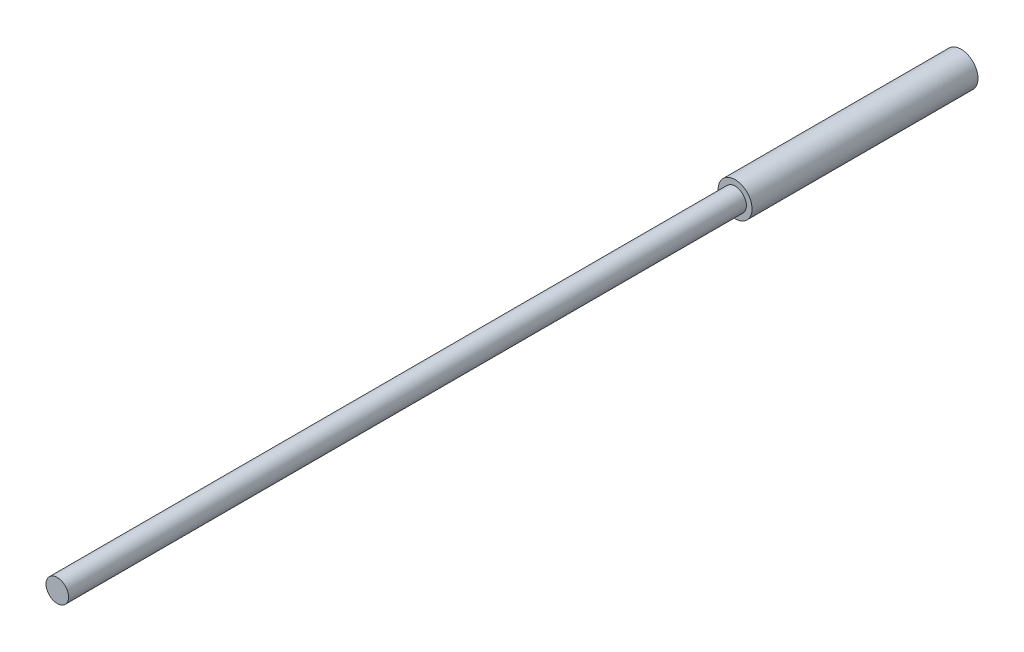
SolidWorks part; units mm, degrees
ref_plane "前视基准面" through (0, 0, 0) normal (0, 0, 1) x (1, 0, 0)
ref_plane "上视基准面" through (0, 0, 0) normal (0, 1, 0) x (1, 0, 0)
ref_plane "右视基准面" through (0, 0, 0) normal (1, 0, 0) x (0, 0, -1)
sketch "草图1" plane through (0, 0, 0) normal (0, 0, 1) x (1, 0, 0)
  circle A0 centre (0, 0) radius 0.75
  dimension "D1" = 1.5
extrude "凸台-拉伸1" add sketch "草图1" along normal blind 10
sketch "草图2" plane through (0, 0, 10) normal (0, 0, 1) x (1, 0, 0)
  circle A0 centre (0, 0) radius 0.5
  dimension "D1" = 1
extrude "凸台-拉伸2" add sketch "草图2" along normal blind 30
sketch "草图3" plane through (0, 0, 0) normal (0, 0, -1) x (-1, 0, 0)
  circle A0 centre (0, 0) radius 0.339 construction
  circle A1 centre (0, 0.2015) radius 0.1375
  circle A2 centre (0.2015, 0) radius 0.1375
  circle A3 centre (0, -0.2015) radius 0.1375
  circle A4 centre (-0.2015, 0) radius 0.1375
  circle A5 centre (-0.2015, 0) radius 0.1325
  circle A6 centre (0, 0.2015) radius 0.1325
  circle A7 centre (0.2015, 0) radius 0.1325
  circle A8 centre (0, -0.2015) radius 0.1325
  dimension "D1" = 0.265
  dimension "D2" = 0.275
  dimension "D3" = 0.01
extrude "切除-拉伸1" cut sketch "草图3" against normal blind 0.1
